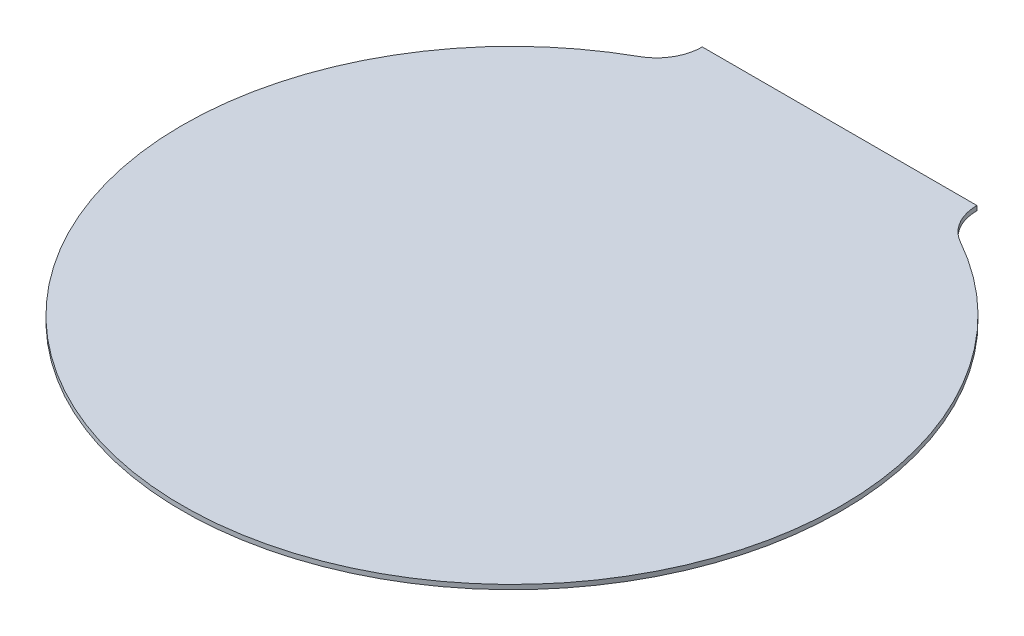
SolidWorks part; units mm, degrees
ref_plane "Front" through (0, 0, 0) normal (0, 0, 1) x (1, 0, 0)
ref_plane "Top" through (0, 0, 0) normal (0, 1, 0) x (1, 0, 0)
ref_plane "Right" through (0, 0, 0) normal (1, 0, 0) x (0, 0, -1)
sketch "Sketch1" plane through (0, 0, 0) normal (0, 1, 0) x (1, 0, 0)
  line L0 (3.8097, 9.0911) -> (-3.8097, 9.0911)
  arc A0 (-4.4602, 7.9824) -> (4.4602, 7.9824) centre (0, 0) ccw
  arc A1 (-4.4602, 7.9824) -> (-3.8097, 9.0911) centre (-5.0797, 9.0911) ccw
  arc A2 (3.8097, 9.0911) -> (4.4602, 7.9824) centre (5.0797, 9.0911) ccw
extrude "Extrude1" add sketch "Sketch1" along normal blind 0.127
